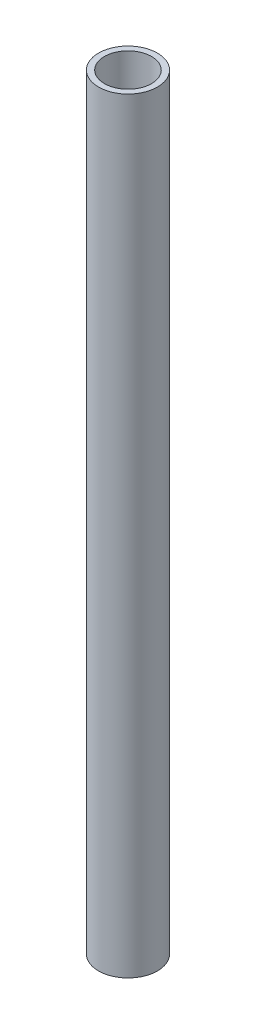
SolidWorks part; units mm, degrees
ref_plane "Front Plane" through (0, 0, 0) normal (0, 0, 1) x (1, 0, 0)
ref_plane "Top Plane" through (0, 0, 0) normal (0, 1, 0) x (1, 0, 0)
ref_plane "Right Plane" through (0, 0, 0) normal (1, 0, 0) x (0, 0, -1)
sketch "Sketch1" plane through (0, 0, 0) normal (0, 1, 0) x (1, 0, 0)
  circle A0 centre (0, 0) radius 10
  circle A1 centre (0, 0) radius 8
  dimension "D1" = 20
  dimension "D2" = 2
extrude "Boss-Extrude1" add sketch "Sketch1" along normal blind 260
